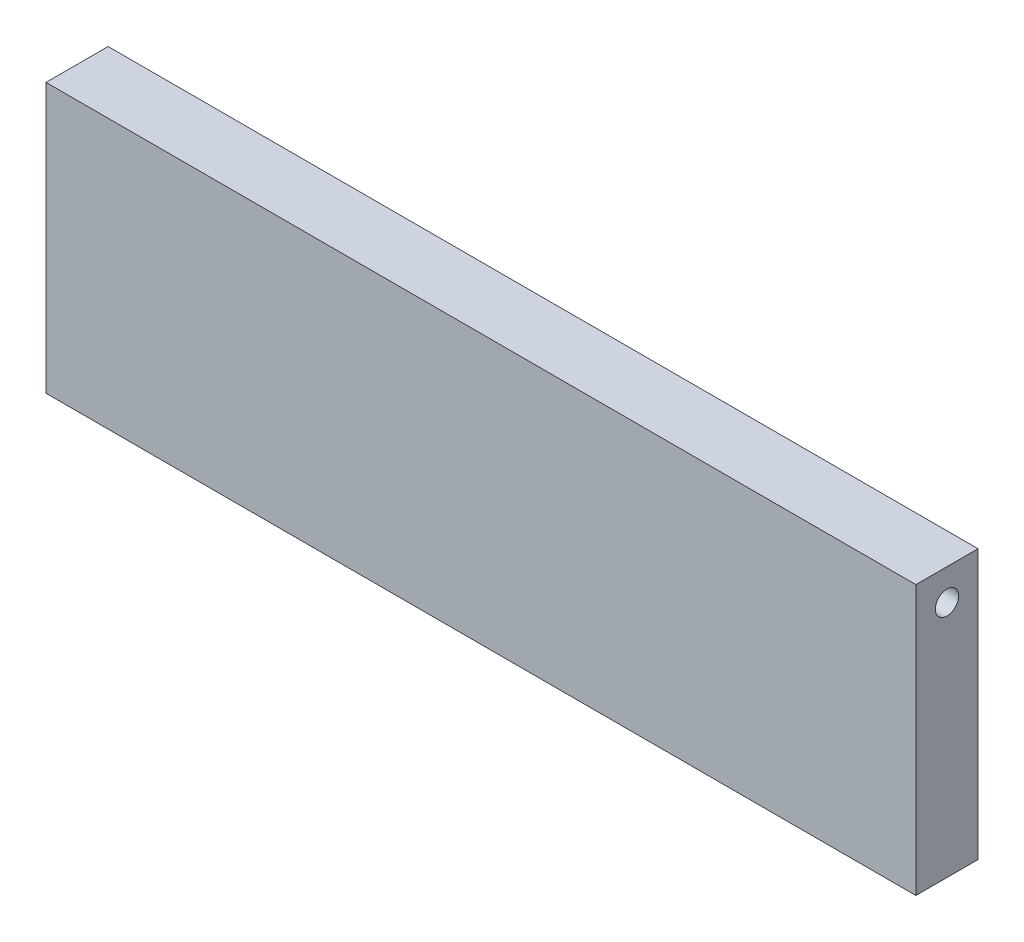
SolidWorks part; units mm, degrees
ref_plane "Front Plane" through (0, 0, 0) normal (0, 0, 1) x (1, 0, 0)
ref_plane "Top Plane" through (0, 0, 0) normal (0, 1, 0) x (1, 0, 0)
ref_plane "Right Plane" through (0, 0, 0) normal (1, 0, 0) x (0, 0, -1)
body saved out of another part "Stock-Donut Shop-1"
hole_wizard "CBORE for M4 Pan Head Machine Screw2" positions "Sketch2" profile "Sketch3" counterbore size "M4" standard "ANSI Metric"
sketch "Sketch2" plane through (48, 0, 0) normal (-1, 0, 0) x (0, 0, 1)
  point P0 (-81, 256)
  point P3 (99, 256)
sketch "Sketch3" plane through (48, 256, -81) normal (0, 1, 0) x (0, 0, 1)
  line L0 (0, 0) -> (0, 30)
  line L1 (0, 30) -> (2.25, 28.6481)
  line L2 (2.25, 28.6481) -> (2.25, 3.1)
  line L3 (2.25, 3.1) -> (4.5, 3.1)
  line L4 (4.5, 3.1) -> (4.5, 0)
  line L5 (4.5, 0) -> (0, 0)
  line L6 (0, 30) -> (-2.25, 28.6481) construction
  line L7 (0, -6.35) -> (0, 107.95) construction
  dimension "Hole Dia." = 4.5
  dimension "Hole Depth" = 30
  dimension "C'Bore Dia." = 9
  dimension "C'Bore Depth" = 3.1
  dimension "Drill Angle" = 118
hole_wizard "CBORE for M4 Pan Head Machine Screw3" positions "3DSketch2" profile "Sketch4" counterbore size "M4" standard "ANSI Metric"
sketch3d "3DSketch2"
  point P0 (240, 256, 99)
  point P3 (240, 256, -81)
  point P6 (240, 47, 99)
  point P9 (240, 6, 99)
  point P12 (240, 6, -99)
sketch "Sketch4" plane through (240, 256, 99) normal (0, 1, 0) x (0, 0, -1)
  line L0 (0, 0) -> (0, 30)
  line L1 (0, 30) -> (2.25, 28.6481)
  line L2 (2.25, 28.6481) -> (2.25, 3.1)
  line L3 (2.25, 3.1) -> (4.5, 3.1)
  line L4 (4.5, 3.1) -> (4.5, 0)
  line L5 (4.5, 0) -> (0, 0)
  line L6 (0, 30) -> (-2.25, 28.6481) construction
  line L7 (0, -6.35) -> (0, 107.95) construction
  dimension "Hole Dia." = 4.5
  dimension "Hole Depth" = 30
  dimension "C'Bore Dia." = 9
  dimension "C'Bore Depth" = 3.1
  dimension "Drill Angle" = 118
ref_plane "Plane1" through (0, 240, 0) normal (0, 1, 0) x (1, 0, 0)
